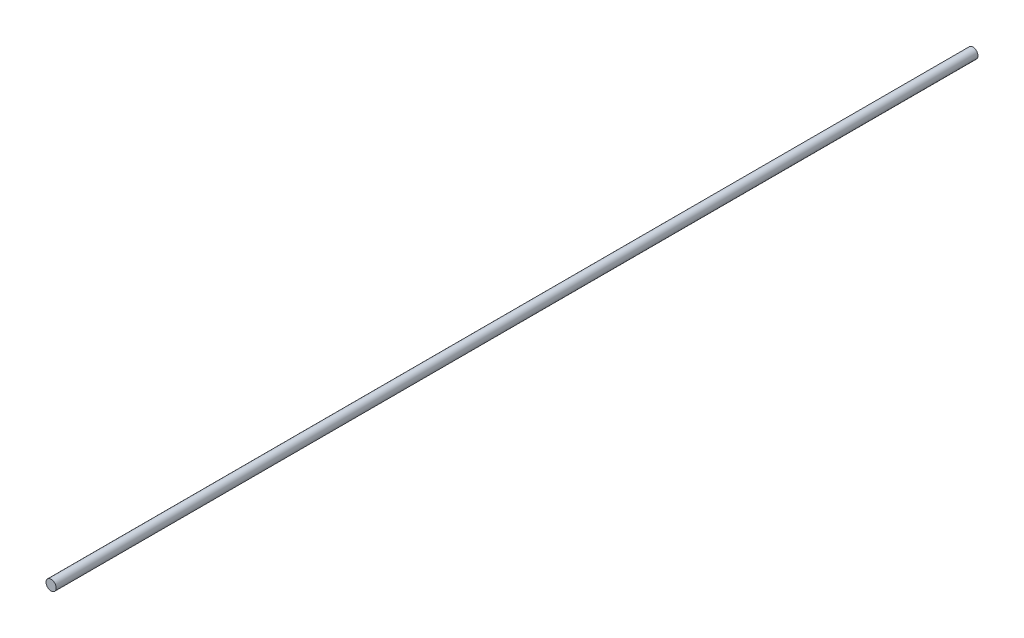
SolidWorks part; units mm, degrees
ref_plane "Front Plane" through (0, 0, 0) normal (0, 0, 1) x (1, 0, 0)
ref_plane "Top Plane" through (0, 0, 0) normal (0, 1, 0) x (1, 0, 0)
ref_plane "Right Plane" through (0, 0, 0) normal (1, 0, 0) x (0, 0, -1)
sketch "Sketch1" plane through (0, 0, 0) normal (0, 0, 1) x (1, 0, 0)
  circle A0 centre (0, 0) radius 30
  dimension "D1" = 60
extrude "Boss-Extrude1" add sketch "Sketch1" against normal blind 5450
